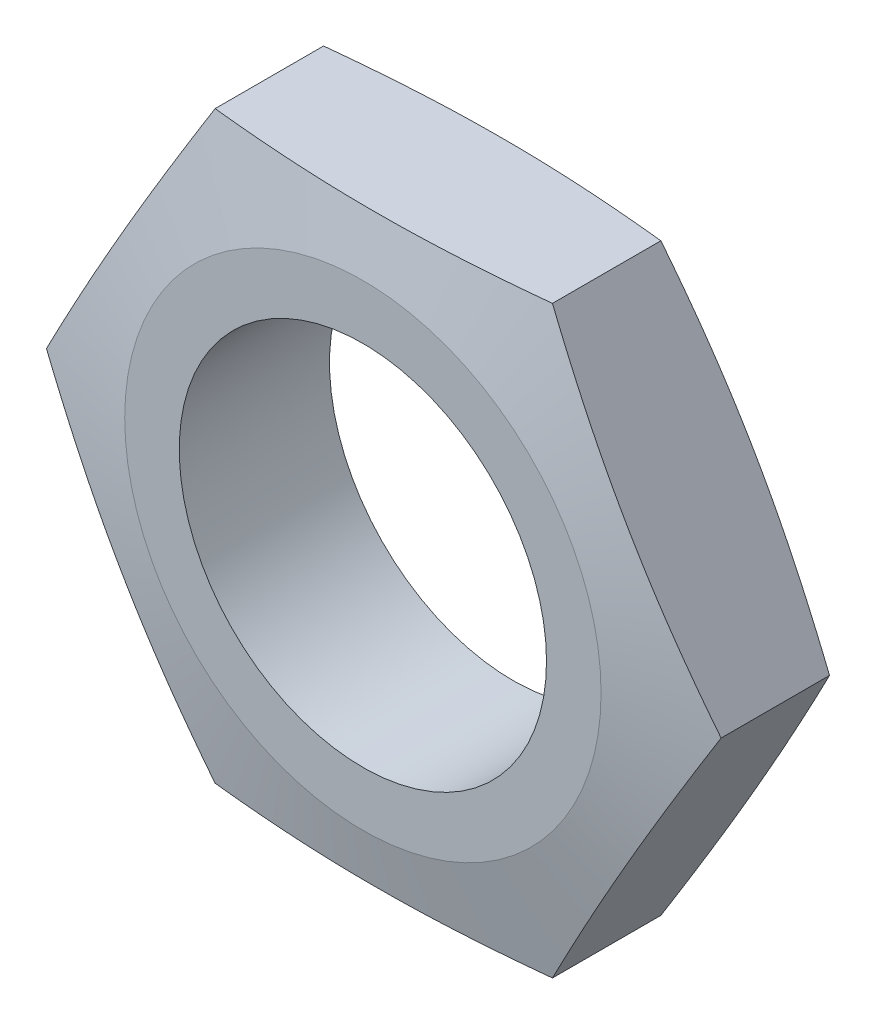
SolidWorks part; units mm, degrees
ref_plane "Front" through (0, 0, 0) normal (0, 0, 1) x (1, 0, 0)
ref_plane "Top" through (0, 0, 0) normal (0, 1, 0) x (1, 0, 0)
ref_plane "Right" through (0, 0, 0) normal (1, 0, 0) x (0, 0, -1)
sketch "Sketch2" plane through (0, 0, 0) normal (0, 0, 1) x (1, 0, 0)
  line L1 (5.1326, -8.89) -> (10.2653, 0)
  line L2 (10.2653, 0) -> (5.1326, 8.89)
  line L3 (5.1326, 8.89) -> (-5.1326, 8.89)
  line L4 (-5.1326, 8.89) -> (-10.2653, 0)
  line L5 (-10.2653, 0) -> (-5.1326, -8.89)
  line L6 (-5.1326, -8.89) -> (5.1326, -8.89)
  circle A0 centre (0, 0) radius 5.588
  circle A1 centre (0, 0) radius 8.89 construction
  dimension "缸径" = 11.176
  dimension "螺母大径" = 17.78
extrude "Base-Extrude" add sketch "Sketch2" along normal mid plane 4.572
sketch "Sketch4" plane through (0, 0, 0) normal (0, 1, 0) x (1, 0, 0)
  line L0 (0, 3.558) -> (0, -4.5381) construction
  line L1 (0, -2.286) -> (0, 2.286) construction
  line L2 (8.9057, 0) -> (2.7758, 0) construction
  line L3 (7.2479, 2.286) -> (10.2653, 1.6496)
  line L4 (10.2653, 2.286) -> (5.1326, 2.286) construction
  line L5 (10.2653, -2.286) -> (10.2653, 2.286) construction
  line L6 (7.2479, -2.286) -> (10.2653, -1.6496)
  line L7 (10.2653, 1.6496) -> (10.2653, 2.286)
  line L8 (10.2653, -1.6496) -> (10.2653, -2.286)
  line L9 (10.2653, 2.286) -> (7.2479, 2.286)
  line L10 (10.2653, -2.286) -> (7.2479, -2.286)
revolve "Cut-Revolve1" cut sketch "Sketch4" angle 360 about L0
